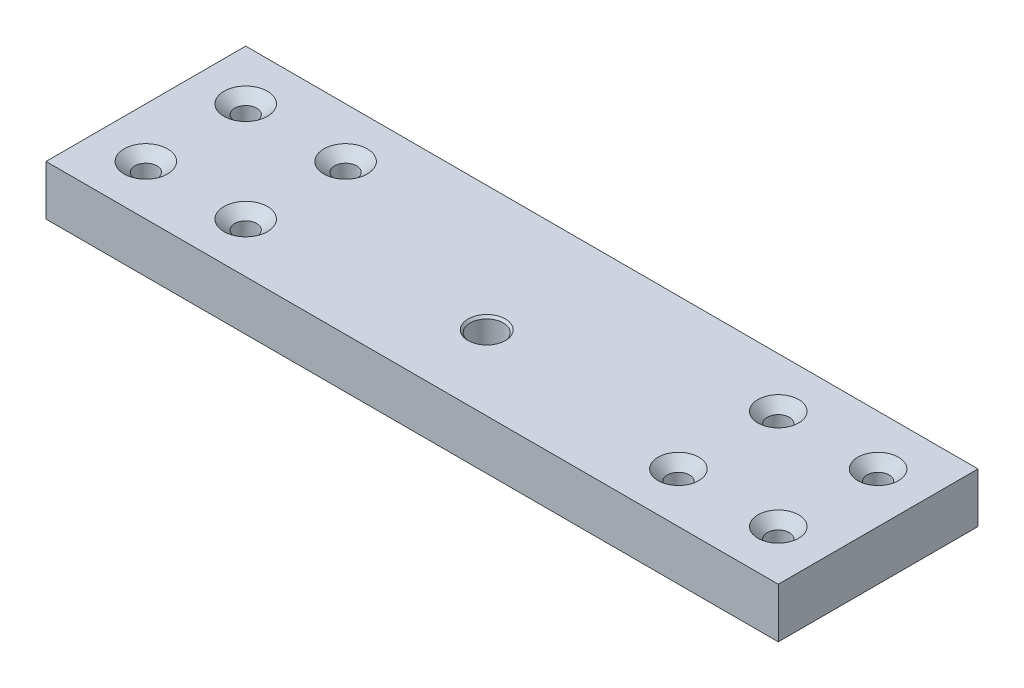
SolidWorks part; units mm, degrees
ref_plane "Front" through (0, 0, 0) normal (0, 0, 1) x (1, 0, 0)
ref_plane "Top" through (0, 0, 0) normal (0, 1, 0) x (1, 0, 0)
ref_plane "Right" through (0, 0, 0) normal (1, 0, 0) x (0, 0, -1)
sketch "Sketch1" plane through (0, 0, 0) normal (0, 1, 0) x (1, 0, 0)
  line L0 (0, 0) -> (-101.6, 0) construction
  line L1 (-120.65, -19.05) -> (-82.55, -19.05) construction
  line L2 (-120.65, -19.05) -> (-120.65, 19.05) construction
  line L3 (-120.65, 19.05) -> (-82.55, 19.05) construction
  line L4 (-82.55, -19.05) -> (-82.55, 19.05) construction
  line L5 (-120.65, -19.05) -> (-82.55, 19.05) construction
  line L6 (-120.65, 19.05) -> (-82.55, -19.05) construction
  line L8 (0, 38.1) -> (-139.7, 38.1)
  line L9 (0, 38.1) -> (0, -38.1)
  line L10 (0, -38.1) -> (-139.7, -38.1)
  line L11 (-139.7, 38.1) -> (-139.7, -38.1)
  line L12 (0, 38.1) -> (-139.7, -38.1) construction
  line L13 (0, -38.1) -> (-139.7, 38.1) construction
  circle A0 centre (-120.65, 19.05) radius 4.2164
  circle A1 centre (-82.55, 19.05) radius 4.2164
  circle A2 centre (-82.55, -19.05) radius 4.2164
  circle A3 centre (-120.65, -19.05) radius 4.2164
  point P4 (-69.85, 0)
  point P8 (-101.6, 0)
  dimension "D2" = 8.4328
  dimension "D1" = 38.1
  dimension "D3" = 101.6
  dimension "D4" = 76.2
  dimension "D5" = 38.1
extrude "Extrude1" add sketch "Sketch1" along normal blind 19.05
mirror "Mirror1" about plane through (0, 19.05, -38.1) normal (-1, 0, 0)
sketch "Sketch2" plane through (0, 19.05, 0) normal (0, 1, 0) x (-1, 0, 0)
  line L0 (0, -38.1) -> (0, 38.1) construction
  line L1 (-139.7, -38.1) -> (139.7, -38.1) construction
  line L2 (139.7, 38.1) -> (-139.7, 38.1) construction
  line L3 (139.7, 0) -> (-139.7, 0) construction
  line L4 (139.7, -38.1) -> (139.7, 38.1) construction
  line L5 (-139.7, -38.1) -> (-139.7, 38.1) construction
  circle A0 centre (0, 9.6418) radius 6.35
  point P17 (0, 9.6418)
  dimension "D1" = 12.7
  dimension "D2" = 9.6418
extrude "Extrude2" cut sketch "Sketch2" against normal through all
chamfer "Chamfer for 91253A313" distance 4.0894 angle 41 8 edges at (120.65, 19.05, -14.8336) (120.65, 19.05, 23.2664) (82.55, 19.05, 23.2664) (82.55, 19.05, -14.8336) (-82.55, 19.05, -14.8336) (-82.55, 19.05, 23.2664) (-120.65, 19.05, 23.2664) (-120.65, 19.05, -14.8336)
sketch "Sketch3" plane through (0, 0, 0) normal (0, -1, 0) x (1, 0, 0)
  line L0 (0, 9.6418) -> (0, 57.15) construction
  line L1 (-25.4, 38.1) -> (-25.4, 63.5)
  line L2 (-139.7, 38.1) -> (139.7, 38.1) construction
  line L3 (-25.4, 63.5) -> (25.4, 63.5)
  line L4 (25.4, 63.5) -> (25.4, 38.1)
  line L5 (-25.4, 38.1) -> (25.4, 38.1)
  line L6 (-139.7, 38.1) -> (-25.4, 38.1) construction
  line L7 (25.4, 38.1) -> (139.7, 38.1) construction
  circle A0 centre (0, 57.15) radius 2.3876
  circle A1 centre (0, 57.15) radius 6.35 construction
  circle A2 centre (0, 57.15) radius 2.3876 construction
  dimension "D1" = 50.8
  dimension "D2" = 25.4
extrude "Extrude3" add sketch "Sketch3" against normal up to surface (19.05 mm away)
sketch "Sketch4" plane through (0, 0, 63.5) normal (0, 0, 1) x (1, 0, 0)
  line L0 (-25.4, 19.05) -> (25.4, 0) construction
  point P4 (0, 9.525)
  point P5 (-39.0161, 30.6578)
hole_wizard "#6-32 Tapped Hole1" positions "3DSketch2" profile "Sketch6" tap size "#6-32" standard "Ansi Inch"
sketch3d "3DSketch2"
  point P0 (0, 9.525, 63.5)
sketch "Sketch6" plane through (0, 9.525, 63.5) normal (1, 0, 0) x (0, -1, 0)
  line L0 (0, 0) -> (0, 11.9887)
  line L1 (0, 11.9887) -> (1.3525, 11.176)
  line L2 (1.3525, 11.176) -> (1.3525, 1.0351)
  line L3 (1.3525, 1.0351) -> (2.3876, 0)
  line L5 (2.3876, 0) -> (0, 0)
  line L6 (-1.3525, 1.0351) -> (-2.3876, 0) construction
  line L10 (0, 11.9887) -> (-1.3525, 11.176) construction
  line L11 (0, -6.35) -> (0, 107.95) construction
  dimension "Tap Drill Dia." = 2.7051
  dimension "Tap Drill Depth" = 11.176
  dimension "Near C'Sink Dia." = 4.7752
  dimension "Near C'Sink Angle" = 90
  dimension "Drill Angle" = 118
chamfer "Chamfer1" distance 0.7937 angle 49 12 edges at (0, 19.05, 54.7624) (0, 0, 54.7624) (0, 0, 15.9918) (0, 19.05, 15.9918) (-120.65, 0, -14.8336) (-120.65, 0, 23.2664) (-82.55, 0, 23.2664) (-82.55, 0, -14.8336) (120.65, 0, 23.2664) (120.65, 0, -14.8336) (82.55, 0, -14.8336) (82.55, 0, 23.2664)
sketch "Sketch7" plane through (0, 19.05, 0) normal (0, 1, 0) x (1, 0, 0)
  line L1 (-139.7, -38.1) -> (139.7, -38.1)
  line L2 (-139.7, -38.1) -> (-139.7, -78.3884)
  line L3 (-139.7, -78.3884) -> (139.7, -78.3884)
  line L4 (139.7, -38.1) -> (139.7, -78.3884)
extrude "Extrude4" cut sketch "Sketch7" against normal through all
